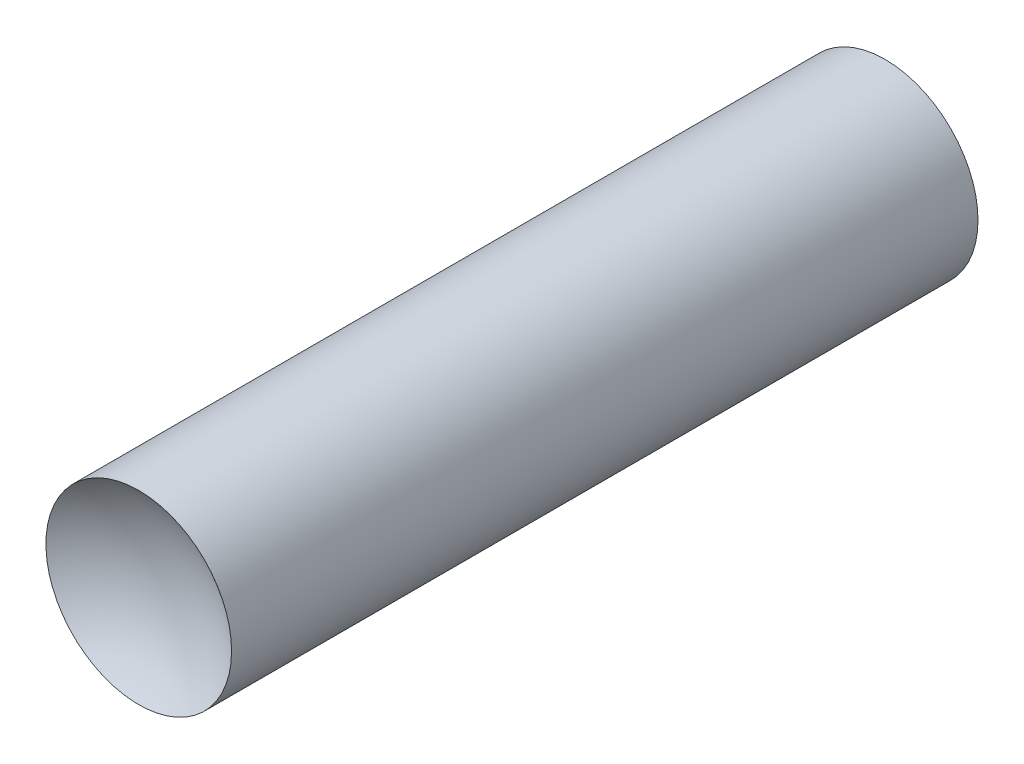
SolidWorks part; units mm, degrees
ref_plane "Спереди" through (0, 0, 0) normal (0, 0, 1) x (1, 0, 0)
ref_plane "Сверху" through (0, 0, 0) normal (0, 1, 0) x (1, 0, 0)
ref_plane "Справа" through (0, 0, 0) normal (1, 0, 0) x (0, 0, -1)
sketch "Эскиз1" plane through (0, 0, 0) normal (1, 0, 0) x (0, 0, -1)
  line L0 (-38.9221, 0) -> (46.6422, 0) construction
  line L1 (-4.4219, 0) -> (4.4219, 0)
  line L2 (-4.826, 1.2002) -> (4.826, 1.2001)
  arc A0 (-4.4219, 0) -> (-4.826, 1.2002) centre (-6.4063, 0) ccw
  arc A1 (4.4219, 0) -> (4.826, 1.2001) centre (6.4063, 0) cw
  dimension "D3" = 1.9844
  dimension "D1" = 2.4003
  dimension "D2" = 9.652
revolve "Повернуть1" add sketch "Эскиз1" angle 360 about L0
